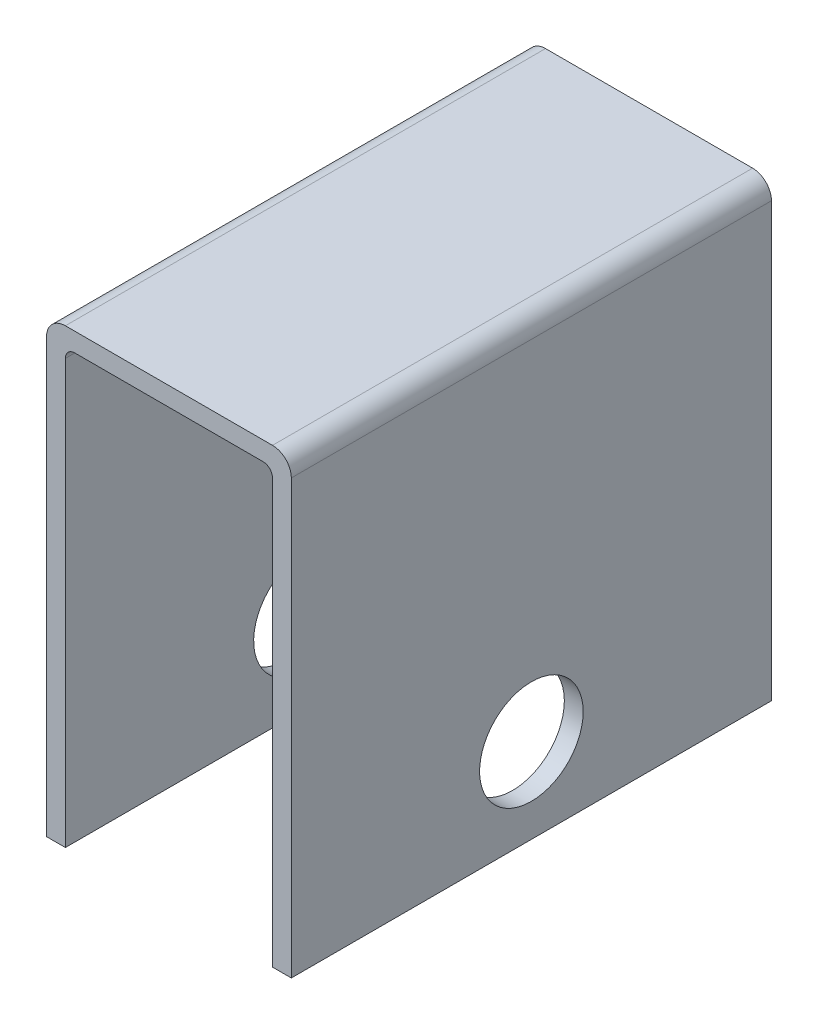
SolidWorks part; units mm, degrees
ref_plane "Plan de face" through (0, 0, 0) normal (0, 0, 1) x (1, 0, 0)
ref_plane "Plan de dessus" through (0, 0, 0) normal (0, 1, 0) x (1, 0, 0)
ref_plane "Plan de droite" through (0, 0, 0) normal (1, 0, 0) x (0, 0, -1)
sketch "Esquisse1" plane through (0, 0, 0) normal (0, 0, 1) x (1, 0, 0)
  line L0 (10, -240) -> (0, -240)
  line L2 (130, -240) -> (130, 0)
  line L3 (130, 0) -> (0, 0)
  line L4 (0, -240) -> (0, 0)
  line L8 (120, -240) -> (120, -10)
  line L9 (120, -10) -> (10, -10)
  line L10 (10, -240) -> (10, -10)
  line L13 (120, -240) -> (130, -240)
  point P0 (0, 0)
  point P6 (0, 0)
  dimension "D1" = 240
  dimension "D2" = 10
  dimension "D3" = 10
  dimension "D4" = 10
  dimension "D5" = 130
extrude "Boss.-Extru.1" add sketch "Esquisse1" along normal blind 255
sketch "Esquisse2" plane through (130, 0, 0) normal (1, 0, 0) x (0, 0, -1)
  line L0 (-255, 0) -> (0, 0) construction
  line L1 (-255, -240) -> (-255, 0) construction
  circle A0 centre (-127.5, -195) radius 27.5
  dimension "D1" = 55
  dimension "D2" = 195
  dimension "D3" = 127.5
extrude "Enlèv. mat.-Extru.1" cut sketch "Esquisse2" against normal through all
fillet "Congé1" radius 10 2 edges at (0, 0, 127.5) (130, 0, 127.5)
fillet "Congé2" radius 5 2 edges at (120, -10, 127.5) (10, -10, 127.5)
